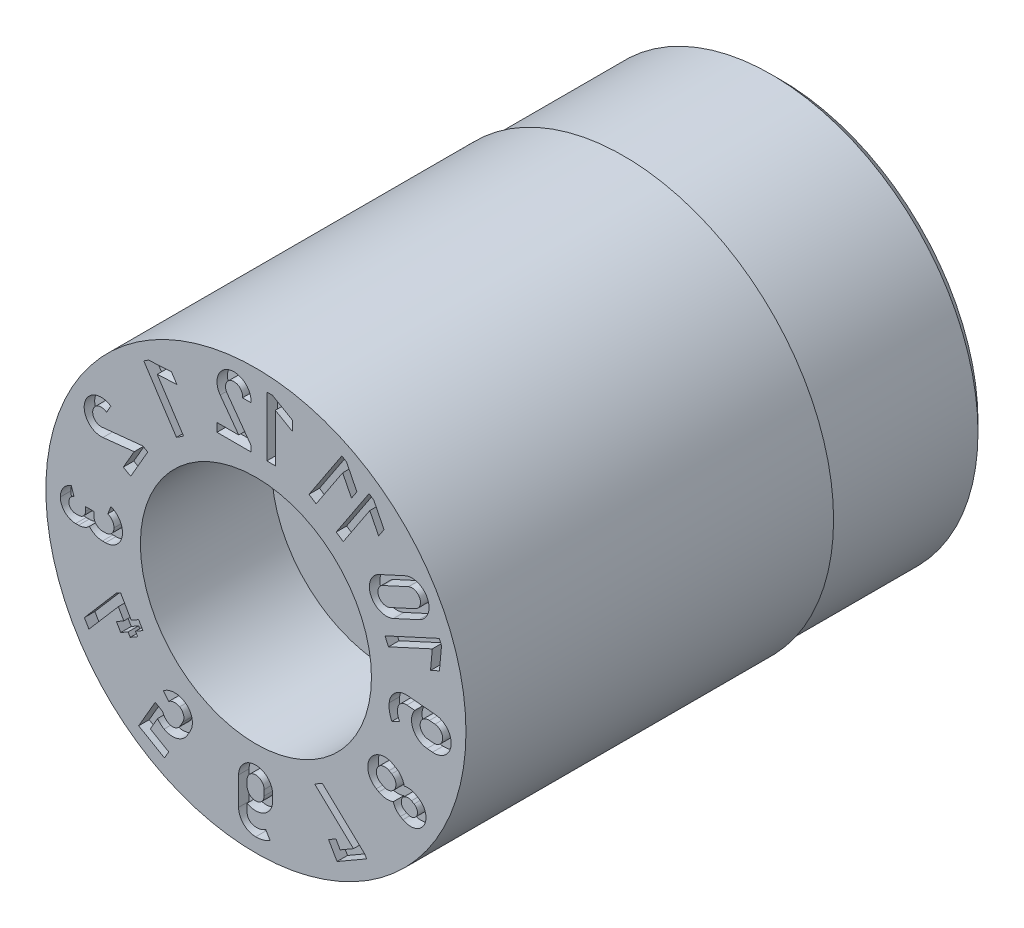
SolidWorks part; units mm, degrees
ref_plane "Front Plane" through (0, 0, 0) normal (0, 0, 1) x (1, 0, 0)
ref_plane "Top Plane" through (0, 0, 0) normal (0, 1, 0) x (1, 0, 0)
ref_plane "Right Plane" through (0, 0, 0) normal (1, 0, 0) x (0, 0, -1)
sketch "Sketch1" plane through (0, 0, 0) normal (1, 0, 0) x (0, 0, -1)
  line L2 (0, 4) -> (0, 2.2)
  line L3 (9.75, 4) -> (0, 4)
  line L4 (-3.7979, 0) -> (49996.2021, 0) construction
  line L8 (10, 1.15) -> (2.5, 1.15)
  line L9 (2.5, 2.2) -> (2.5, 1.15)
  line L10 (2.5, 2.2) -> (0, 2.2)
  line L12 (10, 1.15) -> (10, 3.75)
  line L16 (10, 3.75) -> (9.75, 4)
  dimension "D1" = 10
  dimension "D2" = 45
  dimension "D3" = 0.25
  dimension "D4" = 8
  dimension "D5" = 4.4
  dimension "D6" = 2.5
  dimension "D7" = 2.3
revolve "Revolve1" add sketch "Sketch1" angle 360 about L4
sketch "Sketch4" plane through (0, 0, 0) normal (1, 0, 0) x (0, 0, -1)
  line L0 (0, 0) -> (50000, 0) construction
  line L1 (10, -3.75) -> (10, 3.75) construction
  line L2 (7, 4.935) -> (10, 4.935)
  line L3 (7, 4.935) -> (7, 3.935)
  line L4 (7, 3.935) -> (10, 3.935)
  line L5 (10, 4.935) -> (10, 3.935)
  line L6 (9.75, 4) -> (0, 4) construction
  line L9 (0, 4.4) -> (0, -4.4) construction
  dimension "D1" = 1
  dimension "D2" = 0.065
  dimension "D3" = 7
revolve "Cut-Revolve1" cut sketch "Sketch4" angle 360 about L0
sketch "Sketch2" plane through (0, 0, 0) normal (0, 0, 1) x (1, 0, 0)
  line L345 (2.1542, 3.0063) -> (2.2433, 2.9474)
  line L346 (2.2433, 2.9474) -> (2.4398, 2.5557)
  line L347 (2.4398, 2.5557) -> (2.3366, 2.3996)
  line L348 (2.3366, 2.3996) -> (2.1688, 2.7341)
  line L349 (2.1688, 2.7341) -> (1.6634, 1.9694)
  line L350 (1.6634, 1.9694) -> (1.528, 2.0589)
  line L351 (1.528, 2.0589) -> (2.1542, 3.0063)
  line L352 (1.6376, 3.3707) -> (1.7267, 3.3119)
  line L353 (1.7267, 3.3119) -> (1.9232, 2.9201)
  line L354 (1.9232, 2.9201) -> (1.82, 2.764)
  line L355 (1.82, 2.764) -> (1.6521, 3.0985)
  line L356 (1.6521, 3.0985) -> (1.1467, 2.3338)
  line L357 (1.1467, 2.3338) -> (1.0114, 2.4233)
  line L358 (1.0114, 2.4233) -> (1.6376, 3.3707)
  line L359 (2.5529, 1.3278) -> (3.0394, 1.5512)
  line L360 (2.904, 1.8462) -> (2.4174, 1.6227)
  line L361 (3.4091, -0.1689) -> (3.3041, -0.1591)
  line L362 (3.274, -0.4822) -> (3.3789, -0.492)
  line L363 (3.4242, -0.0073) -> (2.8911, 0.0423)
  line L364 (2.5884, -0.5323) -> (2.7349, -0.4619)
  line L365 (3.3637, -0.6535) -> (3.2588, -0.6441)
  line L366 (3.0242, -0.133) -> (2.876, -0.1192)
  line L367 (2.8327, -1.8789) -> (2.8819, -1.9072)
  line L368 (3.0117, -1.6824) -> (2.9626, -1.654)
  line L369 (1.118, -2.3003) -> (1.2646, -2.2156)
  line L370 (1.2646, -2.2156) -> (2.0684, -2.9731)
  line L371 (2.0684, -2.9731) -> (2.1073, -3.0405)
  line L372 (2.1073, -3.0405) -> (1.5453, -3.365)
  line L373 (1.5453, -3.365) -> (1.3831, -3.084)
  line L374 (1.3831, -3.084) -> (1.5236, -3.0028)
  line L375 (1.5236, -3.0028) -> (1.6047, -3.1433)
  line L376 (1.6047, -3.1433) -> (1.8576, -2.9973)
  line L377 (1.8576, -2.9973) -> (1.118, -2.3003)
  line L378 (2.3739, -1.6514) -> (2.4231, -1.6798)
  line L379 (2.5853, -1.3988) -> (2.5362, -1.3703)
  line L380 (2.6665, -1.2583) -> (2.6173, -1.2299)
  line L381 (2.2928, -1.7919) -> (2.342, -1.8203)
  line L382 (2.7516, -2.0194) -> (2.8008, -2.0477)
  line L383 (3.0927, -1.542) -> (3.0437, -1.5135)
  line L384 (3.4899, 1.2869) -> (3.5345, 1.1899)
  line L385 (3.5345, 1.1899) -> (3.4945, 0.7534)
  line L386 (3.4945, 0.7534) -> (3.3245, 0.6753)
  line L387 (3.3245, 0.6753) -> (3.3585, 1.0481)
  line L388 (3.3585, 1.0481) -> (2.5255, 0.6655)
  line L389 (2.5255, 0.6655) -> (2.4578, 0.8129)
  line L390 (2.4578, 0.8129) -> (3.4899, 1.2869)
  line L391 (2.8363, 1.9936) -> (2.3497, 1.7702)
  line L392 (2.6206, 1.1803) -> (3.1072, 1.4038)
  line L393 (0.2077, 3.7079) -> (0.3145, 3.7079)
  line L394 (0.3145, 3.7079) -> (0.6944, 3.4895)
  line L395 (0.6944, 3.4895) -> (0.6944, 3.3023)
  line L396 (0.6944, 3.3023) -> (0.3699, 3.4889)
  line L397 (0.3699, 3.4889) -> (0.3699, 2.5722)
  line L398 (0.3699, 2.5722) -> (0.2077, 2.5722)
  line L399 (0.2077, 2.5722) -> (0.2077, 3.7079)
  line L400 (-0.7409, 2.5697) -> (-0.0919, 2.5697)
  line L401 (-0.0919, 2.5697) -> (-0.0919, 2.677)
  line L402 (-0.0919, 2.677) -> (-0.5481, 3.3104)
  line L403 (-0.256, 3.3809) -> (-0.0928, 3.3809)
  line L404 (-0.68, 3.2155) -> (-0.3271, 2.732)
  line L405 (-0.3271, 2.732) -> (-0.7409, 2.732)
  line L406 (-0.7409, 2.732) -> (-0.7409, 2.5697)
  line L407 (-2.1352, 3.0505) -> (-2.0458, 3.109)
  line L408 (-2.0458, 3.109) -> (-1.6083, 3.1343)
  line L409 (-1.6083, 3.1343) -> (-1.5058, 2.9777)
  line L410 (-1.5058, 2.9777) -> (-1.8795, 2.9561)
  line L411 (-1.8795, 2.9561) -> (-1.3775, 2.1891)
  line L412 (-1.3775, 2.1891) -> (-1.5132, 2.1003)
  line L413 (-1.5132, 2.1003) -> (-2.1352, 3.0505)
  line L414 (-0.1674, -2.8732) -> (-0.1674, -2.9786)
  line L415 (0.1571, -2.9786) -> (0.1571, -2.8732)
  line L416 (0.3193, -2.8734) -> (0.3197, -2.9786)
  line L417 (-0.1674, -3.2597) -> (-0.1674, -3.4086)
  line L418 (-0.3297, -2.8732) -> (-0.3296, -3.4086)
  line L419 (0.2707, -3.6566) -> (0.187, -3.5173)
  line L420 (-1.8721, -2.7165) -> (-2.0107, -2.9566)
  line L421 (-2.0107, -2.9566) -> (-1.6594, -3.1594)
  line L422 (-1.6594, -3.1594) -> (-1.7406, -3.2999)
  line L423 (-1.7406, -3.2999) -> (-2.2323, -3.016)
  line L424 (-2.2323, -3.016) -> (-1.9174, -2.4706)
  line L425 (-1.9174, -2.4706) -> (-1.7769, -2.5517)
  line L426 (-1.4458, -2.6271) -> (-1.3931, -2.5358)
  line L427 (-1.6618, -2.3297) -> (-1.7628, -2.2025)
  line L428 (-1.2526, -2.6169) -> (-1.3054, -2.7081)
  line L429 (-2.8644, -0.1504) -> (-2.9211, -0.1504)
  line L430 (-3.0834, 0.0118) -> (-3.0834, 0.0929)
  line L431 (-3.0834, 0.0929) -> (-3.2456, 0.0929)
  line L432 (-3.2456, 0.0929) -> (-3.2456, 0.0118)
  line L433 (-3.3754, -0.1179) -> (-3.4322, -0.1179)
  line L434 (-3.4627, 0.1502) -> (-3.5146, 0.3039)
  line L435 (-3.4322, -0.2802) -> (-3.3754, -0.2802)
  line L436 (-2.9211, -0.3126) -> (-2.8643, -0.3126)
  line L437 (-2.7607, 0.3363) -> (-2.8202, 0.1855)
  line L438 (-3.266, -1.7477) -> (-3.18, -1.8965)
  line L439 (-3.18, -1.8965) -> (-2.6195, -1.245)
  line L440 (-2.6195, -1.245) -> (-2.5144, -1.427)
  line L441 (-2.5144, -1.427) -> (-2.6549, -1.5082)
  line L442 (-2.6549, -1.5082) -> (-2.5738, -1.6486)
  line L443 (-2.5738, -1.6486) -> (-2.4333, -1.5675)
  line L444 (-2.4333, -1.5675) -> (-2.3927, -1.6378)
  line L445 (-2.3927, -1.6378) -> (-2.2522, -1.5567)
  line L446 (-2.2522, -1.5567) -> (-2.2928, -1.4864)
  line L447 (-2.2928, -1.4864) -> (-2.1523, -1.4053)
  line L448 (-2.1523, -1.4053) -> (-2.2334, -1.2648)
  line L449 (-2.2334, -1.2648) -> (-2.3739, -1.3459)
  line L450 (-2.3739, -1.3459) -> (-2.5767, -0.9947)
  line L451 (-2.5767, -0.9947) -> (-2.6589, -1.0421)
  line L452 (-2.6589, -1.0421) -> (-3.266, -1.7477)
  line L453 (-2.5247, 1.1038) -> (-2.3841, 1.0227)
  line L454 (-2.3841, 1.0227) -> (-2.0597, 1.5847)
  line L455 (-2.0597, 1.5847) -> (-2.1526, 1.6384)
  line L456 (-2.1526, 1.6384) -> (-2.9292, 1.56)
  line L457 (-2.8442, 1.8482) -> (-2.7626, 1.9895)
  line L458 (-2.9129, 1.3983) -> (-2.3178, 1.4621)
  line L459 (-2.3178, 1.4621) -> (-2.5247, 1.1038)
  arc A162 (2.4174, 1.6227) -> (2.5529, 1.3278) centre (2.4852, 1.4752) ccw
  arc A163 (3.0394, 1.5512) -> (2.904, 1.8462) centre (2.9717, 1.6987) ccw
  arc A164 (3.3041, -0.1591) -> (3.274, -0.4822) centre (3.289, -0.3207) ccw
  arc A165 (3.3789, -0.492) -> (3.4091, -0.1689) centre (3.394, -0.3305) ccw
  arc A166 (2.8911, 0.0423) -> (2.5378, -0.2506) centre (2.861, -0.2808) ccw
  arc A167 (2.5378, -0.2506) -> (2.5884, -0.5323) centre (3.0705, -0.3004) ccw
  arc A168 (3.3637, -0.6535) -> (3.4242, -0.0073) centre (3.3939, -0.3304) ccw
  arc A169 (3.0242, -0.133) -> (3.2588, -0.6441) centre (3.2878, -0.3214) ccw
  arc A170 (2.876, -0.1192) -> (2.701, -0.2533) centre (2.8609, -0.2807) ccw
  arc A171 (2.701, -0.2533) -> (2.7349, -0.4619) centre (3.0219, -0.3083) ccw
  arc A172 (2.9626, -1.654) -> (2.8327, -1.8789) centre (2.8975, -1.7663) ccw
  arc A173 (2.8819, -1.9072) -> (3.0117, -1.6824) centre (2.9468, -1.7948) ccw
  arc A174 (2.5362, -1.3703) -> (2.3739, -1.6514) centre (2.4551, -1.5109) ccw
  arc A175 (2.4231, -1.6798) -> (2.5853, -1.3988) centre (2.5042, -1.5393) ccw
  arc A176 (2.8239, -1.4838) -> (2.6665, -1.2583) centre (2.5042, -1.5393) ccw
  arc A177 (2.6173, -1.2299) -> (2.2928, -1.7919) centre (2.4549, -1.5107) ccw
  arc A178 (2.342, -1.8203) -> (2.6161, -1.8439) centre (2.5042, -1.5393) ccw
  arc A179 (2.6161, -1.8439) -> (2.7516, -2.0194) centre (2.898, -1.7662) ccw
  arc A180 (2.8008, -2.0477) -> (3.0927, -1.542) centre (2.9468, -1.7949) ccw
  arc A181 (3.0437, -1.5135) -> (2.8239, -1.4838) centre (2.898, -1.7639) ccw
  arc A182 (2.3497, 1.7702) -> (2.6206, 1.1803) centre (2.4852, 1.4752) ccw
  arc A183 (3.1072, 1.4038) -> (2.8363, 1.9936) centre (2.9717, 1.6987) ccw
  arc A184 (-0.256, 3.3809) -> (-0.5481, 3.3104) centre (-0.4164, 3.4053) ccw
  arc A185 (-0.0928, 3.3809) -> (-0.68, 3.2155) centre (-0.4165, 3.4051) ccw
  arc A186 (-0.1674, -2.9786) -> (0.1571, -2.9786) centre (-0.0051, -2.9786) ccw
  arc A187 (0.1571, -2.8732) -> (-0.1674, -2.8732) centre (-0.0051, -2.8732) ccw
  arc A188 (0.3193, -2.8734) -> (-0.3297, -2.8732) centre (-0.0052, -2.8733) ccw
  arc A189 (-0.1674, -3.2597) -> (0.3197, -2.9786) centre (-0.0043, -2.9798) ccw
  arc A190 (-0.1674, -3.4086) -> (-0.0176, -3.5704) centre (-0.0052, -3.4086) ccw
  arc A191 (-0.0176, -3.5704) -> (0.187, -3.5173) centre (0.0073, -3.2457) ccw
  arc A192 (-0.3296, -3.4086) -> (-0.0051, -3.7331) centre (-0.005, -3.4085) ccw
  arc A193 (-0.0051, -3.7331) -> (0.2707, -3.6566) centre (-0.005, -3.1981) ccw
  arc A194 (-1.7769, -2.5517) -> (-1.6674, -2.6865) centre (-1.5456, -2.4756) ccw
  arc A195 (-1.6674, -2.6865) -> (-1.4458, -2.6271) centre (-1.5863, -2.5461) ccw
  arc A196 (-1.3931, -2.5358) -> (-1.4525, -2.3141) centre (-1.5335, -2.4546) ccw
  arc A197 (-1.4525, -2.3141) -> (-1.6618, -2.3297) centre (-1.5457, -2.4759) ccw
  arc A198 (-1.3713, -2.1736) -> (-1.7628, -2.2025) centre (-1.5459, -2.4754) ccw
  arc A199 (-1.2526, -2.6169) -> (-1.3713, -2.1736) centre (-1.5339, -2.4547) ccw
  arc A200 (-1.7486, -2.8269) -> (-1.3054, -2.7081) centre (-1.5866, -2.5453) ccw
  arc A201 (-1.8721, -2.7165) -> (-1.7486, -2.8269) centre (-1.5481, -2.4783) ccw
  arc A202 (-2.7021, 0.0119) -> (-2.8202, 0.1855) centre (-2.8887, 0.0119) ccw
  arc A203 (-2.8644, -0.1504) -> (-2.7021, 0.0119) centre (-2.8644, 0.0119) ccw
  arc A204 (-3.0834, 0.0118) -> (-2.9211, -0.1504) centre (-2.9211, 0.0118) ccw
  arc A205 (-3.3754, -0.1179) -> (-3.2456, 0.0118) centre (-3.3754, 0.0118) ccw
  arc A206 (-3.562, 0.0118) -> (-3.4322, -0.1179) centre (-3.4321, 0.012) ccw
  arc A207 (-3.4627, 0.1502) -> (-3.562, 0.0118) centre (-3.4162, 0.012) ccw
  arc A208 (-3.5146, 0.3039) -> (-3.7242, 0.0119) centre (-3.4159, 0.0118) ccw
  arc A209 (-3.7242, 0.0119) -> (-3.4322, -0.2802) centre (-3.4322, 0.0118) ccw
  arc A210 (-3.3754, -0.2802) -> (-3.1703, -0.196) centre (-3.3754, 0.0117) ccw
  arc A211 (-3.1703, -0.196) -> (-2.9211, -0.3126) centre (-2.9212, 0.0117) ccw
  arc A212 (-2.8643, -0.3126) -> (-2.5399, 0.0118) centre (-2.8643, 0.0118) ccw
  arc A213 (-2.5399, 0.0118) -> (-2.7607, 0.3363) centre (-2.8888, 0.0118) ccw
  arc A214 (-2.8442, 1.8482) -> (-2.9292, 1.56) centre (-2.9455, 1.7214) ccw
  arc A215 (-2.7626, 1.9895) -> (-2.9129, 1.3983) centre (-2.9454, 1.7213) ccw
  point P668 (0, 0.0063)
  point P669 (0.0063, 0.0063)
  point P670 (0.0063, 0)
extrude "Cut-Extrude1" cut sketch "Sketch2" against normal blind 0.2
